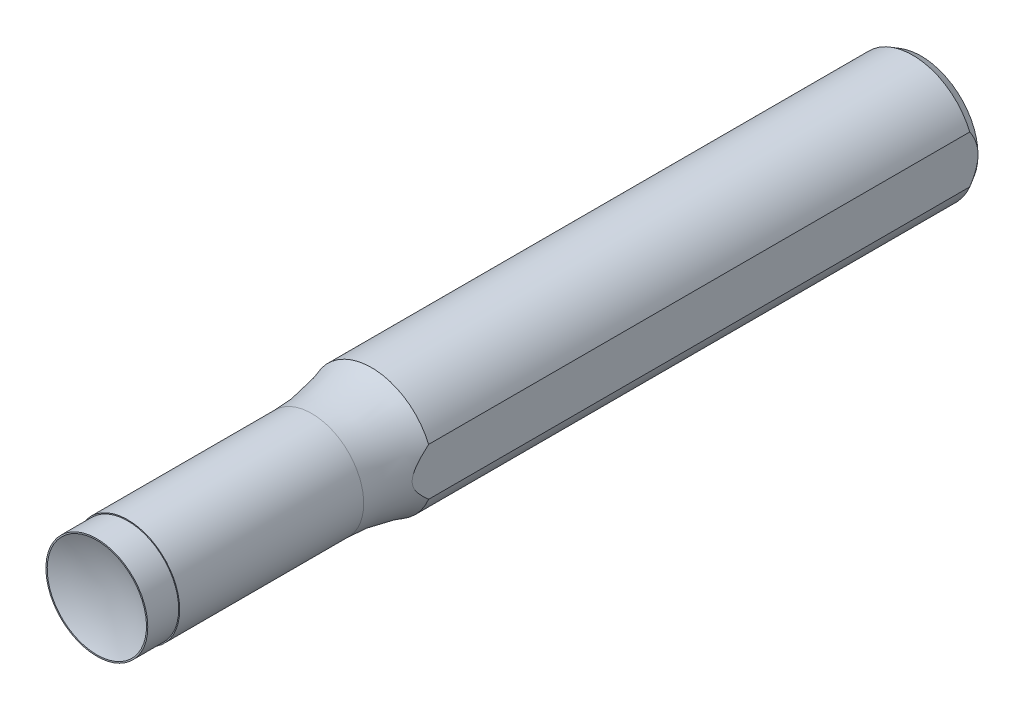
SolidWorks part; units mm, degrees
ref_plane "Front Plane" through (0, 0, 0) normal (0, 0, 1) x (1, 0, 0)
ref_plane "Top Plane" through (0, 0, 0) normal (0, 1, 0) x (1, 0, 0)
ref_plane "Right Plane" through (0, 0, 0) normal (1, 0, 0) x (0, 0, -1)
sketch "Sketch1" plane through (0, 0, 0) normal (0, 0, 1) x (1, 0, 0)
  circle A0 centre (0, 0) radius 9.525
  dimension "D1" = 19.05
extrude "Boss-Extrude1" add sketch "Sketch1" against normal blind 127
sketch "Sketch2" plane through (0, 0, 0) normal (0, 0, 1) x (1, 0, 0)
  circle A0 centre (0, 0) radius 8
  dimension "D1" = 16
extrude "Cut-Extrude1" cut sketch "Sketch2" against normal blind 42.3333 flip side to cut
sketch "Sketch3" plane through (0, 0, 0) normal (0, 0, 1) x (1, 0, 0)
  circle A0 centre (0, 0) radius 7.85
  dimension "D1" = 15.7
extrude "Cut-Extrude2" cut sketch "Sketch3" against normal blind 4.7625 flip side to cut
sketch "Sketch4" plane through (0, 0, 0) normal (1, 0, 0) x (0, 0, -1)
  line L0 (0, 0) -> (0, 7.65)
  line L1 (0, 7.85) -> (0, -7.85) construction
  line L2 (1.6035, 0) -> (1.6035, 7.65) construction
  line L3 (0, 0) -> (1.6035, 0)
  line L4 (0, 0) -> (0, -7.65) construction
  arc A0 (1.6035, 0) -> (0, 7.65) centre (-17.4465, 0) ccw
  dimension "D2" = 19.05
  dimension "D1" = 15.3
revolve "Cut-Revolve1" cut sketch "Sketch4" angle 360 about L3
chamfer "Chamfer1" distance 1.27 angle 30 1 edges at (9.525, 0, -127)
sketch "Sketch5" plane through (0, 0, 0) normal (1, 0, 0) x (0, 0, -1)
  line L0 (42.3333, 0) -> (33.1231, 0)
  line L1 (42.3333, 9.525) -> (42.3333, -9.525) construction
  line L2 (33.1231, 0) -> (33.1231, 8)
  line L3 (42.3333, 8) -> (4.7625, 8) construction
  line L4 (42.3333, 9.525) -> (42.3333, 0)
  line L5 (33.1231, 8) -> (42.3333, 8) construction
  arc A0 (33.1231, 8) -> (42.3333, 9.525) centre (33.1231, 36.575) ccw
  dimension "D1" = 28.575
revolve "Revolve1" add sketch "Sketch5" angle 360 about L0
sketch "Sketch6" plane through (0, 0, 0) normal (1, 0, 0) x (0, 0, -1)
  line L0 (84.6667, 0) -> (108.4867, 0)
  line L1 (84.6667, 0) -> (84.6667, 19.05)
  line L2 (84.6667, 19.05) -> (91.9889, 19.05)
  line L3 (108.4867, 0) -> (108.4867, 9.525)
  line L4 (125.73, 9.525) -> (42.3333, 9.525) construction
  line L5 (108.4867, 9.525) -> (84.6667, 9.525) construction
  line L6 (127, -9.525) -> (127, 9.525) construction
  arc A0 (108.4867, 9.525) -> (91.9889, 19.05) centre (108.4867, 28.575) cw
  dimension "D2" = 19.05
  dimension "D1" = 42.3333
  dimension "D3" = 23.82
revolve "Revolve2" [suppressed] add sketch "Sketch6" angle 360 about L0
sketch "Sketch7" plane through (0, 0, -127) normal (0, 0, -1) x (-1, 0, 0)
  line L9 (-16.1213, 3.6648) -> (-8.7918, 3.6648)
  line L10 (-16.1213, 3.6648) -> (-16.1213, -3.6648)
  line L11 (-16.1213, -3.6648) -> (-8.7918, -3.6648)
  line L12 (-8.7918, 3.6648) -> (-8.7918, -3.6648)
  circle A5 centre (0, 0) radius 9.525 construction
  circle A6 centre (0, 0) radius 8.7918 construction
  point P8 (-8.7918, 0)
extrude "Cut-Extrude3" cut sketch "Sketch7" against normal through all
